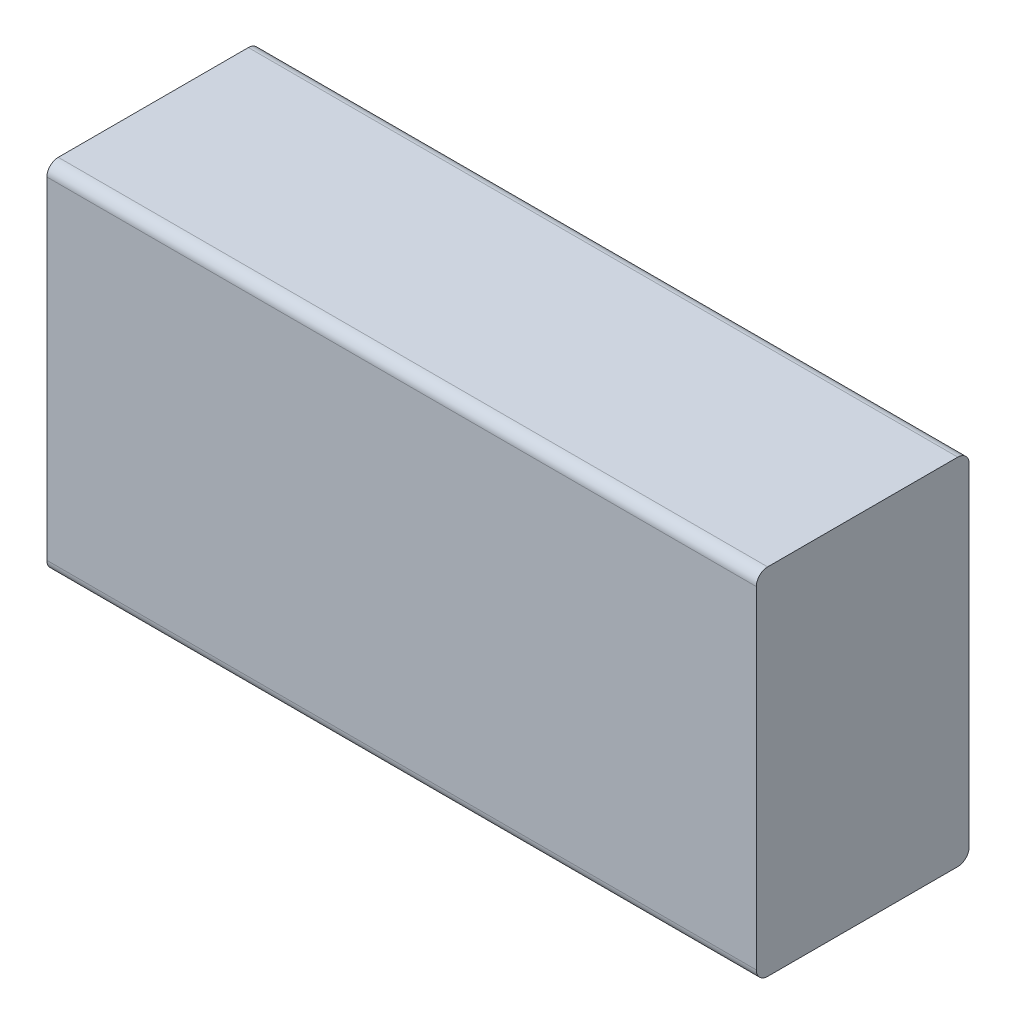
SolidWorks part; units mm, degrees
ref_plane "Front" through (0, 0, 0) normal (0, 0, 1) x (1, 0, 0)
ref_plane "Top" through (0, 0, 0) normal (0, 1, 0) x (1, 0, 0)
ref_plane "Right" through (0, 0, 0) normal (1, 0, 0) x (0, 0, -1)
other "Configuration Table"
sketch "Sketch1" plane through (0, 0, 0) normal (0, 0, 1) x (1, 0, 0)
  line L0 (0, 2.5) -> (-7.5, 2.5)
  line L1 (-7.5, -2.5) -> (0, -2.5)
  line L2 (-7.5, 2.5) -> (-7.5, -2.5)
  arc A2 (0, 2.5) -> (0, -2.5) centre (0, 0) cw
  dimension "b" = 5
  dimension "l" = 10
extrude "Extrude1" add sketch "Sketch1" along normal blind 3
sketch "Sketch2" plane through (0, 0, 0) normal (0, 0, 1) x (1, 0, 0)
  line L2 (2.5, 2.5) -> (2.5, -2.5)
  line L6 (0, 2.5) -> (-7.5, 2.5)
  line L7 (-7.5, 2.5) -> (-7.5, -2.5)
  line L8 (-7.5, -2.5) -> (0, -2.5)
  line L9 (2.5, 2.5) -> (-7.5, 2.5)
  line L10 (-7.5, 2.5) -> (-7.5, -2.5)
  line L11 (-7.5, -2.5) -> (2.5, -2.5)
  arc A3 (0, -2.5) -> (0, 2.5) centre (0, 0) ccw
  arc A4 (0, -2.5) -> (0, 2.5) centre (0, 0) ccw construction
  dimension "D1" = 0
extrude "Extrude2" add sketch "Sketch2" along normal blind 3
fillet "Fillet1" radius 0.16 4 edges at (-2.5, -2.5, 0) (-2.5, -2.5, 3) (-2.5, 2.5, 0) (-2.5, 2.5, 3)
equation "\"D1@Extrude2\" = \"h@Extrude1\""
